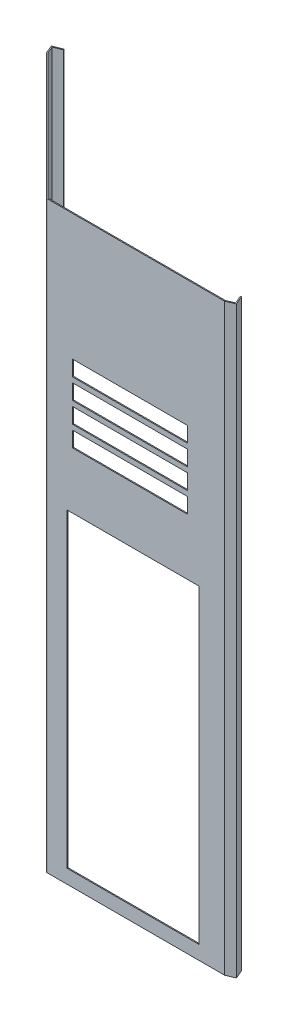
SolidWorks part; units mm, degrees
ref_plane "Plan de face" through (0, 0, 0) normal (0, 0, 1) x (1, 0, 0)
ref_plane "Plan de dessus" through (0, 0, 0) normal (0, 1, 0) x (1, 0, 0)
ref_plane "Plan de droite" through (0, 0, 0) normal (1, 0, 0) x (0, 0, -1)
sketch "Esquisse1" plane through (0, 0, 0) normal (0, 1, 0) x (1, 0, 0)
  line L0 (0, 0) -> (-695, 0)
  line L1 (-695, 0) -> (-1186.4392, 491.4392)
  line L2 (0, 0) -> (32.2177, 13.6756)
  line L3 (32.2177, 13.6756) -> (17.3699, 48.6548)
  line L4 (-1186.4392, 491.4392) -> (-1199.5504, 523.8906)
  line L5 (-1199.5504, 523.8906) -> (-1164.3175, 538.1257)
  dimension "D1" = 695
  dimension "D2" = 695
  dimension "D3" = 135
  dimension "D4" = 35
  dimension "D5" = 23
  dimension "D6" = 38
  dimension "D7" = 35
  dimension "D8" = 38
  dimension "D9" = 23
extrude "Extru.-Mince1" add sketch "Esquisse1" along normal blind 2276 thin
fillet "Congé1" radius 4 1 edges at (-695, 1138, 0)
fillet "Congé2" radius 2 1 edges at (-693.3431, 1138, -4)
sketch "Esquisse2" plane through (0, 0, 0) normal (0, 0, 1) x (1, 0, 0)
  line L0 (0, 0) -> (-693.3431, 0) construction
  line L1 (-614, 1264) -> (-100, 1264)
  line L2 (-614, 1264) -> (-614, 54)
  line L3 (-614, 54) -> (-100, 54)
  line L4 (-100, 1264) -> (-100, 54)
  line L7 (-594, 1784) -> (-144, 1784)
  line L8 (-594, 1784) -> (-594, 1724)
  line L9 (-594, 1724) -> (-144, 1724)
  line L10 (-144, 1784) -> (-144, 1724)
  line L11 (-594, 1544) -> (-144, 1544)
  line L12 (-594, 1544) -> (-594, 1484)
  line L13 (-594, 1484) -> (-144, 1484)
  line L14 (-144, 1544) -> (-144, 1484)
  line L15 (-594, 1704) -> (-144, 1704)
  line L16 (-594, 1704) -> (-594, 1644)
  line L17 (-594, 1644) -> (-144, 1644)
  line L18 (-144, 1704) -> (-144, 1644)
  line L19 (-594, 1624) -> (-144, 1624)
  line L20 (-594, 1624) -> (-594, 1564)
  line L21 (-594, 1564) -> (-144, 1564)
  line L22 (-144, 1624) -> (-144, 1564)
  line L23 (0, 2276) -> (-693.3431, 2276) construction
  line L24 (0, 2276) -> (0, 0) construction
  dimension "D1" = 54
  dimension "D2" = 1210
  dimension "D3" = 100
  dimension "D4" = 514
  dimension "D5" = 144
  dimension "D6" = 492
  dimension "D7" = 450
  dimension "D8" = 60
  dimension "D9" = 80
  dimension "D10" = 160
  dimension "D11" = 240
extrude "Enlèv. mat.-Extru.1" cut sketch "Esquisse2" against normal through all
sketch "Esquisse3" plane through (-347.5, 0, 347.5) normal (-0.7071, 0, 0.7071) x (0.7071, 0, 0.7071)
  line L0 (-493.0961, 0) -> (-1186.4392, 0) construction
  line L1 (-979.4392, 0) -> (-549.4392, 0)
  line L2 (-979.4392, 0) -> (-979.4392, 665)
  line L3 (-979.4392, 665) -> (-549.4392, 665)
  line L4 (-549.4392, 0) -> (-549.4392, 665)
  line L6 (-493.0961, 2276) -> (-1186.4392, 2276) construction
  line L7 (-1042.4392, 1584) -> (-592.4392, 1584)
  line L8 (-1042.4392, 1584) -> (-1042.4392, 1524)
  line L9 (-1042.4392, 1524) -> (-592.4392, 1524)
  line L10 (-592.4392, 1584) -> (-592.4392, 1524)
  line L11 (-1186.4392, 2276) -> (-1186.4392, 0) construction
  line L12 (-1042.4392, 1504) -> (-592.4392, 1504)
  line L13 (-1042.4392, 1504) -> (-1042.4392, 1444)
  line L14 (-1042.4392, 1444) -> (-592.4392, 1444)
  line L15 (-592.4392, 1504) -> (-592.4392, 1444)
  line L16 (-1042.4392, 1424) -> (-592.4392, 1424)
  line L17 (-1042.4392, 1424) -> (-1042.4392, 1364)
  line L18 (-1042.4392, 1364) -> (-592.4392, 1364)
  line L19 (-592.4392, 1424) -> (-592.4392, 1364)
  line L20 (-1042.4392, 1344) -> (-592.4392, 1344)
  line L21 (-1042.4392, 1344) -> (-1042.4392, 1284)
  line L22 (-1042.4392, 1284) -> (-592.4392, 1284)
  line L23 (-592.4392, 1344) -> (-592.4392, 1284)
  line L24 (-1042.4392, 1264) -> (-592.4392, 1264)
  line L25 (-1042.4392, 1264) -> (-1042.4392, 1204)
  line L26 (-1042.4392, 1204) -> (-592.4392, 1204)
  line L27 (-592.4392, 1264) -> (-592.4392, 1204)
  dimension "D1" = 665
  dimension "D2" = 430
  dimension "D3" = 207
  dimension "D4" = 450
  dimension "D5" = 692
  dimension "D6" = 144
  dimension "D7" = 60
  dimension "D8" = 80
  dimension "D9" = 160
  dimension "D10" = 240
  dimension "D11" = 320
extrude "Enlèv. mat.-Extru.2" cut sketch "Esquisse3" against normal through all
